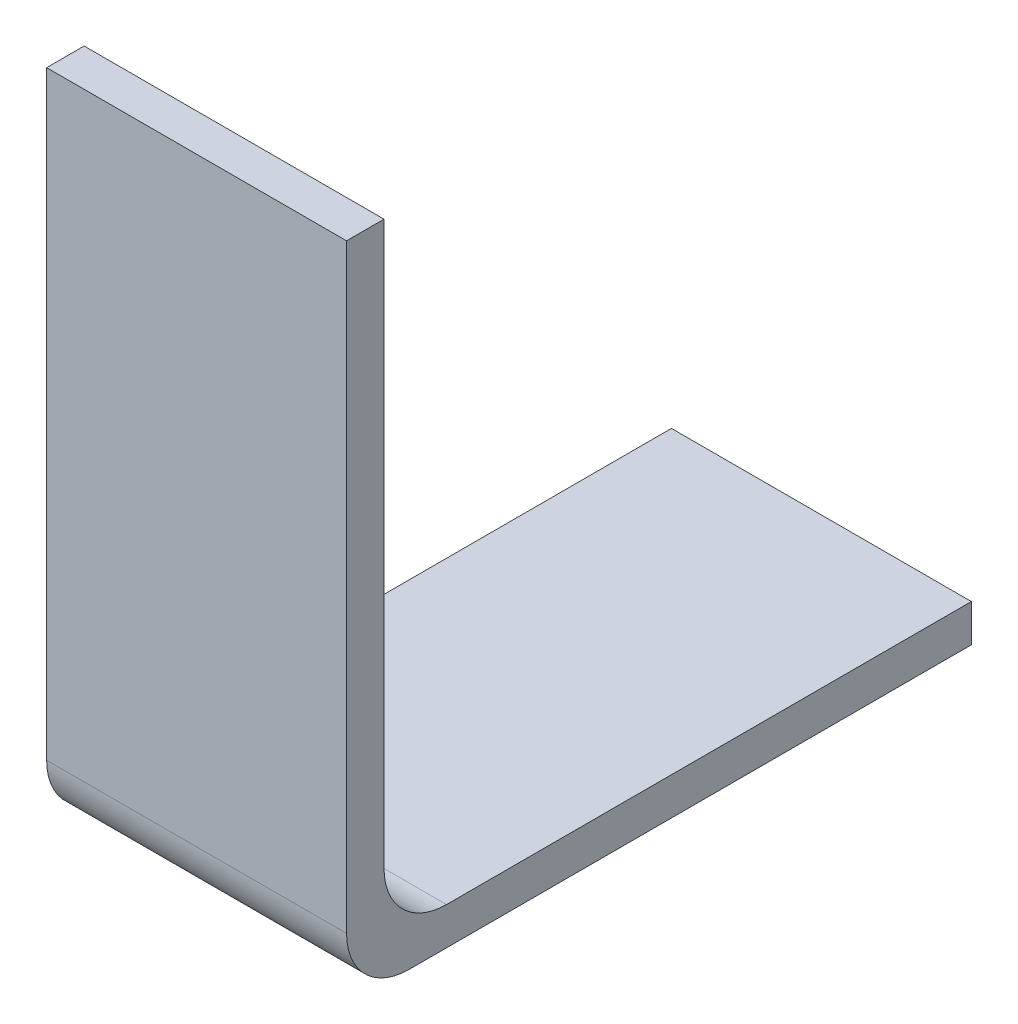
SolidWorks part; units mm, degrees
ref_plane "Plane1" through (0, 0, 0) normal (0, 0, 1) x (1, 0, 0)
ref_plane "Plane2" through (0, 0, 0) normal (0, 1, 0) x (1, 0, 0)
ref_plane "Plane3" through (0, 0, 0) normal (1, 0, 0) x (0, 0, -1)
sketch "Sketch1" plane through (0, 0, 0) normal (0, 0, 1) x (1, 0, 0)
  line L1 (0, 0) -> (6.096, 0)
  line L2 (0, 0) -> (0, -0.762)
  line L3 (0, -0.762) -> (6.096, -0.762)
  line L4 (6.096, 0) -> (6.096, -0.762)
  dimension "D1" = 6.096
  dimension "D2" = 0.762
extrude "Base-Extrude" add sketch "Sketch1" along normal blind 12.7
sketch "Sketch2" plane through (0, 0, 0) normal (0, 1, 0) x (-1, 0, 0)
  line L0 (0, 12.7) -> (0, 0) construction
  line L1 (-6.096, 12.7) -> (0, 12.7)
  line L2 (-6.096, 12.7) -> (-6.096, 11.938)
  line L3 (-6.096, 11.938) -> (0, 11.938)
  line L4 (0, 12.7) -> (0, 11.938)
  dimension "D1" = 0.762
extrude "Boss-Extrude1" add sketch "Sketch2" along normal blind 12.7
fillet "Fillet1" radius 1.27
